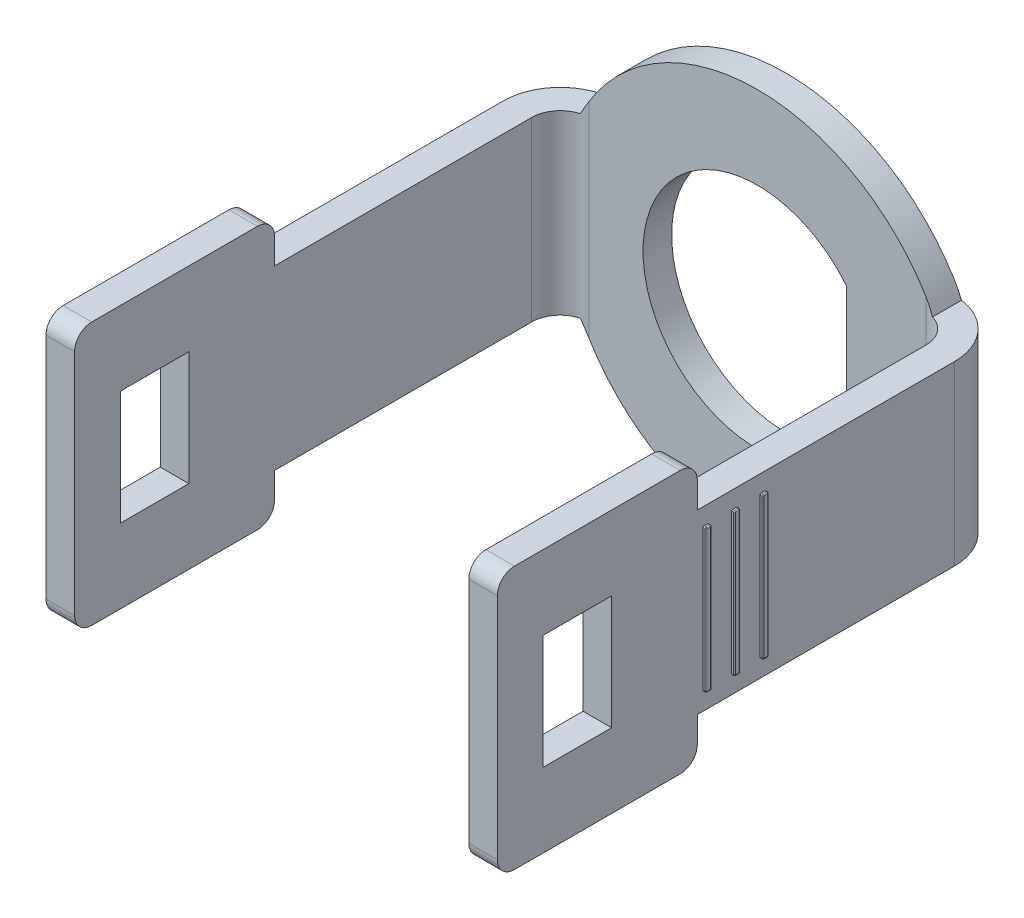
SolidWorks part; units mm, degrees
ref_plane "Front" through (0, 0, 0) normal (0, 0, 1) x (1, 0, 0)
ref_plane "Top" through (0, 0, 0) normal (0, 1, 0) x (1, 0, 0)
ref_plane "Right" through (0, 0, 0) normal (1, 0, 0) x (0, 0, -1)
sketch "Sketch1" plane through (0, 0, 0) normal (0, 0, 1) x (1, 0, 0)
  line L1 (0, 0) -> (20.066, 0)
  line L2 (0, 0) -> (0, -7.874)
  line L3 (0, -7.874) -> (20.066, -7.874)
  line L4 (20.066, 0) -> (20.066, -7.874)
  dimension "D1" = 20.066
  dimension "D2" = 7.874
extrude "Extrude1" add sketch "Sketch1" along normal blind 1.27
sketch "Sketch2" plane through (0, 0, 0) normal (0, 0, -1) x (-1, 0, 0)
  circle A0 centre (-10.033, -3.937) radius 8.763
  dimension "D1" = 17.526
  dimension "D2" = 3.937
  dimension "D3" = 10.033
extrude "Extrude2" add sketch "Sketch2" against normal blind 1.27
sketch "Sketch3" plane through (0, 0, 0) normal (0, 0, -1) x (-1, 0, 0)
  line L0 (-13.9986, -0.762) -> (-13.9986, -7.112)
  arc A0 (-13.9986, -0.762) -> (-13.9986, -7.112) centre (-10.033, -3.937) cw
  arc A1 (-2.2042, 0) -> (-17.8618, 0) centre (-10.033, -3.937) ccw construction
  arc A2 (-17.8618, -7.874) -> (-2.2042, -7.874) centre (-10.033, -3.937) ccw construction
  dimension "D1" = 5.08
  dimension "D2" = 6.35
extrude "Cut-Extrude1" cut sketch "Sketch3" against normal blind 2.54
sketch "Sketch4" plane through (0, 0, 1.27) normal (0, 0, 1) x (1, 0, 0)
  line L1 (0, 0) -> (1.27, 0)
  line L2 (0, 0) -> (0, -7.874)
  line L3 (0, -7.874) -> (1.27, -7.874)
  line L4 (1.27, 0) -> (1.27, -7.874)
  line L5 (20.066, 0) -> (18.796, 0)
  line L6 (20.066, 0) -> (20.066, -7.874)
  line L7 (20.066, -7.874) -> (18.796, -7.874)
  line L8 (18.796, 0) -> (18.796, -7.874)
  dimension "D1" = 1.27
  dimension "D2" = 1.27
  dimension "D3" = 7.874
  dimension "D4" = 7.874
extrude "Extrude4" add sketch "Sketch4" along normal blind 12.7
fillet "Fillet1" radius 2.54
fillet "Fillet2" radius 1.27
sketch "Sketch5" plane through (0, 0, 13.97) normal (0, 0, 1) x (1, 0, 0)
  line L1 (18.796, 1.905) -> (20.066, 1.905)
  line L2 (18.796, 1.905) -> (18.796, -9.779)
  line L3 (18.796, -9.779) -> (20.066, -9.779)
  line L4 (20.066, 1.905) -> (20.066, -9.779)
  line L5 (0, 1.905) -> (1.27, 1.905)
  line L6 (0, 1.905) -> (0, -9.779)
  line L7 (0, -9.779) -> (1.27, -9.779)
  line L8 (1.27, 1.905) -> (1.27, -9.779)
  line L10 (1.27, 0) -> (0, 0) construction
  line L11 (20.066, 0) -> (18.796, 0) construction
  line L12 (0, 0) -> (0, -7.874) construction
  line L13 (20.066, -7.874) -> (20.066, 0) construction
  dimension "D1" = 11.684
  dimension "D2" = 11.684
  dimension "D3" = 1.905
  dimension "D4" = 1.905
  dimension "D5" = 1.27
  dimension "D6" = 1.27
extrude "Extrude5" add sketch "Sketch5" along normal blind 8.89
fillet "Fillet3" radius 0.762
sketch "Sketch6" plane through (0, 0, 0) normal (-1, 0, 0) x (0, 0, 1)
  line L1 (17.78, -1.397) -> (20.828, -1.397)
  line L2 (17.78, -1.397) -> (17.78, -6.477)
  line L3 (17.78, -6.477) -> (20.828, -6.477)
  line L4 (20.828, -1.397) -> (20.828, -6.477)
  line L6 (1.27, 0.6067) -> (1.27, 4.826) construction
  line L8 (22.098, 1.905) -> (14.732, 1.905) construction
  dimension "D1" = 19.558
  dimension "D2" = 5.08
  dimension "D3" = 3.048
  dimension "D4" = 3.302
extrude "Cut-Extrude2" cut sketch "Sketch6" against normal blind 23.114
sketch "Sketch7" plane through (0, 0, 0) normal (-1, 0, 0) x (0, 0, 1)
  line L0 (13.97, 1.143) -> (13.97, 0) construction
  line L1 (13.462, -0.762) -> (13.716, -0.762)
  line L2 (13.462, -0.762) -> (13.462, -7.112)
  line L3 (13.462, -7.112) -> (13.716, -7.112)
  line L4 (13.716, -0.762) -> (13.716, -7.112)
  line L5 (12.192, -0.762) -> (12.446, -0.762)
  line L6 (12.192, -0.762) -> (12.192, -7.112)
  line L7 (12.192, -7.112) -> (12.446, -7.112)
  line L8 (12.446, -0.762) -> (12.446, -7.112)
  line L9 (10.922, -0.762) -> (11.176, -0.762)
  line L10 (10.922, -0.762) -> (10.922, -7.112)
  line L11 (10.922, -7.112) -> (11.176, -7.112)
  line L12 (11.176, -0.762) -> (11.176, -7.112)
  line L14 (20.828, -1.397) -> (17.78, -1.397) construction
  dimension "D1" = 0.635
  dimension "D2" = 0.254
  dimension "D3" = 0.254
  dimension "D4" = 6.35
  dimension "D5" = 1.27
  dimension "D6" = 0.254
  dimension "D7" = 0.254
  dimension "D8" = 1.27
extrude "Extrude6" add sketch "Sketch7" along normal blind 0.127
fillet "Fillet4" radius 0.0508
ref_plane "Plane1" through (10.033, 4.826, 1.27) normal (1, 0, 0) x (0, 0, -1)
mirror "Mirror3" about plane through (10.033, 4.826, 1.27) normal (1, 0, 0)
